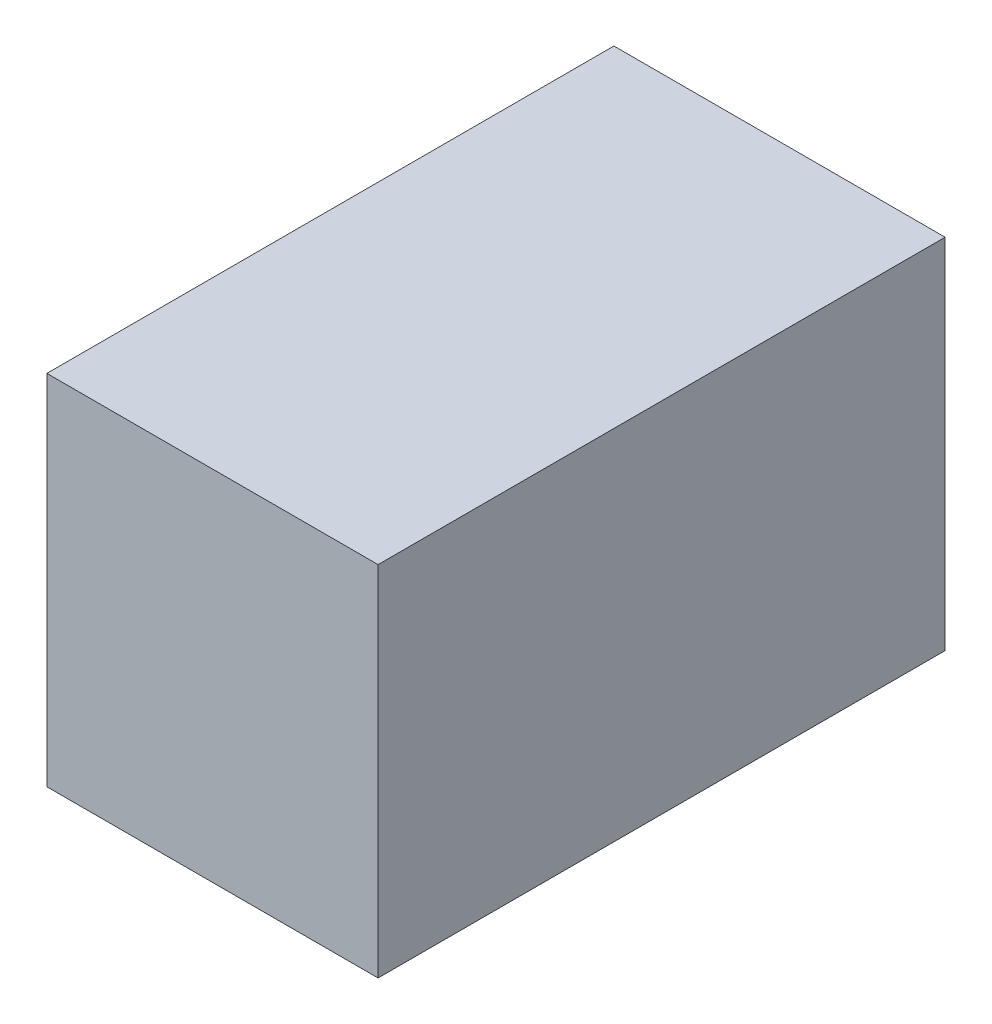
SolidWorks part; units mm, degrees
ref_plane "Vorne" through (0, 0, 0) normal (0, 0, 1) x (1, 0, 0)
ref_plane "Oben" through (0, 0, 0) normal (0, 1, 0) x (1, 0, 0)
ref_plane "Rechts" through (0, 0, 0) normal (1, 0, 0) x (0, 0, -1)
imported_body "Oberfläche-Importiert2"
surface "Oberfläche-Offset1" parameters "D1"=0
surface "Oberfläche-Verlängern1" parameters "D1"=2, "D2"=2
surface "Oberfläche-Trimmen1"
delete or keep bodies "Körper-Löschen1" type delete bodies bodies 106
other "Fläche löschen1"
surface "Oberfläche-Ausformung1"
surface "Oberfläche-Zusammenfügen3"
sketch "Skizze1" plane through (0, 0, 679.498) normal (0, 0, 1) x (1, 0, 0)
  line L1 (2683.7496, -81.5627) -> (2780.0485, -81.5627)
  line L2 (2683.7496, -81.5627) -> (2683.7496, 22.5303)
  line L3 (2683.7496, 22.5303) -> (2780.0485, 22.5303)
  line L4 (2780.0485, -81.5627) -> (2780.0485, 22.5303)
  line L5 (2683.7496, -81.5627) -> (2780.0485, 22.5303) construction
  line L6 (2683.7496, 22.5303) -> (2780.0485, -81.5627) construction
  point P0 (2731.899, -29.5162)
extrude "Bitte löschen !" add sketch "Skizze1" against normal blind 164.8674
